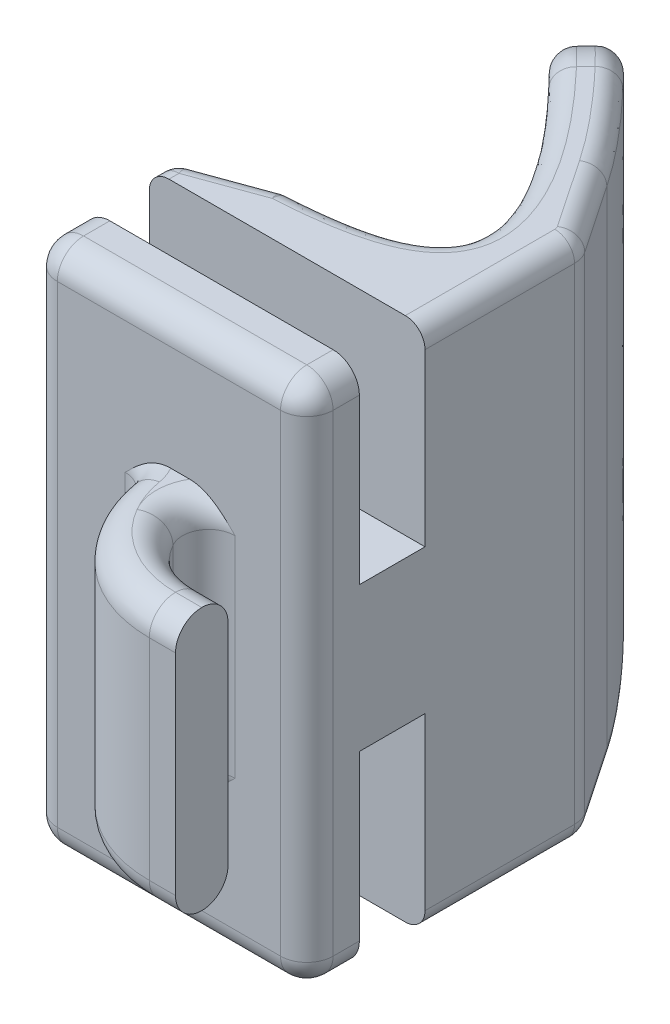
SolidWorks part; units mm, degrees
ref_plane "Front Plane" through (0, 0, 0) normal (0, 0, 1) x (1, 0, 0)
ref_plane "Top Plane" through (0, 0, 0) normal (0, 1, 0) x (1, 0, 0)
ref_plane "Right Plane" through (0, 0, 0) normal (1, 0, 0) x (0, 0, -1)
sketch "Sketch1" plane through (0, 0, 0) normal (0, 1, 0) x (1, 0, 0)
  line L0 (-27.3333, -16.125) -> (-16.8333, -16.125)
  line L1 (-27.3333, -11.625) -> (-27.3333, -16.125) construction
  spline S0 degree 3 poles (-27.3333, -11.625) (-23.339, -11.625) (-16.5111, -11.0911) (-17.6586, -5.246) (-24.4958, 1.1315) knots 0 0 0 0 0.393691 1 1 1 1
  dimension "D1" = 10.5
  dimension "D2" = 4.5
extrude "Extrude-Thin1" add sketch "Sketch1" along normal blind 20 thin contours S0 | L0
ref_plane "Plane1" through (0, 10, 0) normal (0, 1, 0) x (1, 0, 0)
sketch "Sketch2" plane through (-27.3333, 0, 0) normal (-1, 0, 0) x (0, 0, 1)
  line L0 (12.625, 20) -> (12.625, 0) construction
  line L1 (12.625, 12.75) -> (15.125, 12.75)
  line L2 (12.625, 12.75) -> (12.625, 7.25)
  line L3 (12.625, 7.25) -> (15.125, 7.25)
  line L4 (15.125, 12.75) -> (15.125, 7.25)
  line L5 (15.125, 20) -> (15.125, 0) construction
  line L6 (15.125, 20) -> (15.125, 0) construction
  line L7 (12.625, 20) -> (12.625, 0) construction
  point P8 (12.625, 10)
  dimension "D1" = 5.5
extrude "Boss-Extrude3" add sketch "Sketch2" against normal up to surface (10.5 mm away)
sketch "Sketch5" plane through (0, 0, 0) normal (0, 1, 0) x (1, 0, 0)
  line L0 (-16.8333, -12.625) -> (-27.3333, -12.625) construction
  line L1 (-16.8333, -12.625) -> (-27.3333, -12.625)
  line L3 (-16.8333, -12.625) -> (-16.8333, -6.625)
  line L4 (-18.7549, -3.7789) -> (-16.8333, -6.625)
  spline S0 degree 3 poles (-1814.0444, 892.9965) (-317.2357, 175.3256) (-50.7727, 34.2337) (-19.3112, -2.9326) (-18.5906, -3.95) (-17.5508, -5.8296) (-17.2282, -6.6939) (-17.0488, -7.9244) (-17.0411, -8.3237) (-17.1401, -9.0906) (-17.2478, -9.4576) (-17.5713, -10.1292) (-17.7862, -10.4326) (-18.2909, -10.9605) (-18.5795, -11.1855) (-19.2079, -11.5685) (-19.5482, -11.7269) (-20.275, -11.9932) (-20.6619, -12.1014) (-21.8972, -12.37) (-22.8208, -12.4759) (-67.5415, -15.229) (-315.344, 57.8314) (-1442.284, -1410.3116) knots -3.900448 -3.900448 -3.900448 -3.900448 0.125 0.125 0.25 0.25 0.375 0.375 0.4375 0.4375 0.5 0.5 0.5625 0.5625 0.625 0.625 0.6875 0.6875 0.75 0.75 0.875 0.875 6.129153 6.129153 6.129153 6.129153 only from (-23.8137, 1.8628) to (-27.3333, -12.625) construction
  spline S1 degree 3 poles (-18.7549, -3.7789) (-18.4966, -4.1614) (-18.269, -4.5313) (-17.5508, -5.8296) (-17.2282, -6.6939) (-17.0488, -7.9244) (-17.0411, -8.3237) (-17.1401, -9.0906) (-17.2478, -9.4576) (-17.5713, -10.1292) (-17.7862, -10.4326) (-18.2909, -10.9605) (-18.5795, -11.1855) (-19.2079, -11.5685) (-19.5482, -11.7269) (-20.275, -11.9932) (-20.6619, -12.1014) (-21.8972, -12.37) (-22.8208, -12.4759) (-24.8992, -12.6039) (-26.054, -12.625) (-27.3333, -12.625) knots 0.202308 0.202308 0.202308 0.202308 0.25 0.25 0.375 0.375 0.4375 0.4375 0.5 0.5 0.5625 0.5625 0.625 0.625 0.6875 0.6875 0.75 0.75 0.875 0.875 1 1 1 1
  dimension "D1" = 6
extrude "Boss-Extrude4" add sketch "Sketch5" along normal up to surface (20 mm away)
chamfer "Chamfer1" distance 3 angle 20 1 edges at (-27.3333, 10, 10.625)
sketch "Sketch6" plane through (0, 10, 0) normal (0, 1, 0) x (1, 0, 0)
  line L0 (-27.3333, -17.125) -> (-16.8333, -17.125) construction
  line L1 (-17.8333, -21.125) -> (-16.8333, -21.125)
  line L3 (-16.8333, -12.625) -> (-16.8333, -6.625) construction
  arc A0 (-21.8333, -17.125) -> (-17.8333, -21.125) centre (-17.8333, -17.125) ccw
  dimension "D2" = 4
  dimension "D1" = 1
extrude "Extrude-Thin2" add sketch "Sketch6" against normal mid plane 10 thin
fillet "Fillet1" radius 3 2 edges at (-24.4958, 20, -1.1315) (-24.4958, 0, -1.1315)
fillet "Fillet2" radius 0.75 20 edges at (-25.1779, 10, -0.4003) (-23.8137, 10, -1.8628) (-27.3333, 20, 12.171) (-16.8333, 20, 9.625) (-16.8333, 0, 9.625) (-27.3333, 0, 12.171) (-23.3354, 18.874, -1.4118) (-22.9961, 0.6558, -1.0857) (-24.3604, 19.3444, 0.3773) (-24.6997, 1.126, 0.0508) (-24.1346, 10, 10.5527) (-27.3333, 10, 11.7169) (-25.734, 0, 11.1348) (-25.734, 20, 11.1348)
fillet "Fillet3" radius 1 5 edges at (-17.053, 0.2197, 6.6922) (-17.053, 19.7803, 6.6922) (-22.8333, 10, 17.125) (-20.8333, 10, 17.125) (-16.8333, 10, 6.625)
fillet "Fillet4" radius 1 20 edges at (-27.3333, 0, 16.125) (-16.8333, 0, 16.125) (-16.8333, 20, 16.125) (-27.3333, 20, 16.125) (-16.8333, 10, 17.125) (-27.3333, 10, 17.125) (-22.0833, 0, 17.125) (-22.0833, 20, 17.125) (-20.4314, 15, 17.625) (-17.3333, 15, 20.125) (-23.1039, 15, 17.3612) (-17.3333, 15, 22.125) (-23.1039, 5, 17.3612) (-17.3333, 5, 22.125) (-20.4314, 5, 17.625) (-17.3333, 5, 20.125) (-19.3333, 15, 19.7231) (-21.0608, 15, 20.9438) (-21.0608, 5, 20.9438) (-19.3333, 5, 19.7231)
